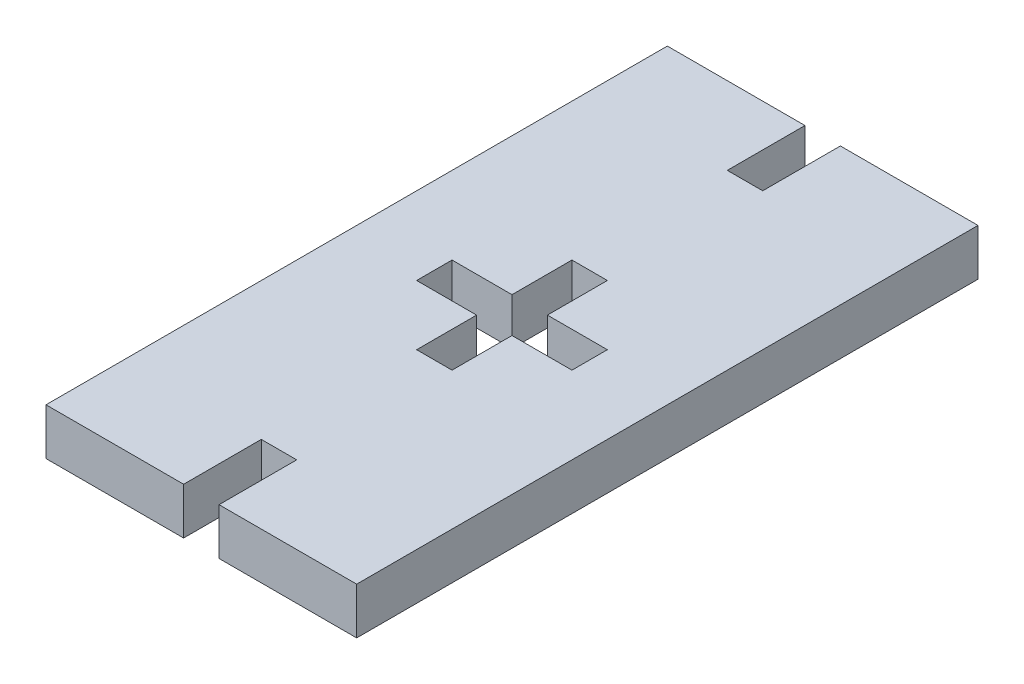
SolidWorks part; units mm, degrees
ref_plane "Alzado" through (0, 0, 0) normal (0, 0, 1) x (1, 0, 0)
ref_plane "Planta" through (0, 0, 0) normal (0, 1, 0) x (1, 0, 0)
ref_plane "Vista lateral" through (0, 0, 0) normal (1, 0, 0) x (0, 0, -1)
sketch "Sketch1" plane through (0, 0, 0) normal (0, 1, 0) x (1, 0, 0)
  line L1 (-10, -20) -> (10, -20)
  line L2 (-10, -20) -> (-10, 20)
  line L3 (-10, 20) -> (10, 20)
  line L4 (10, -20) -> (10, 20)
  line L5 (-10, -20) -> (10, 20) construction
  line L6 (-10, 20) -> (10, -20) construction
  point P0 (0, 0)
extrude "Boss-Extrude1" add sketch "Sketch1" along normal blind 3
sketch "Sketch4" plane through (0, 3, 0) normal (0, 1, 0) x (1, 0, 0)
  line L0 (0, -20) -> (0, 20) construction
  line L1 (-10, -20) -> (10, -20) construction
  line L2 (10, 20) -> (-10, 20) construction
  line L3 (10, 0) -> (-10, 0) construction
  line L4 (-1.14, 25) -> (1.14, 25)
  line L5 (-1.14, 25) -> (-1.14, 15)
  line L6 (-1.14, 15) -> (1.14, 15)
  line L7 (1.14, 25) -> (1.14, 15)
  line L8 (-1.14, 25) -> (1.14, 15) construction
  line L9 (-1.14, 15) -> (1.14, 25) construction
  line L10 (10, -20) -> (10, 20) construction
  line L11 (-10, 20) -> (-10, -20) construction
  line L12 (-1.14, -15) -> (1.14, -15)
  line L13 (1.14, -25) -> (1.14, -15)
  line L14 (-1.14, -25) -> (1.14, -25)
  line L15 (-1.14, -25) -> (-1.14, -15)
extrude "Cut-Extrude8" cut sketch "Sketch4" against normal blind 3 contours L7 L6 L5 L4 | L14 L13 L12 L15
sketch "Sketch5" plane through (0, 3, 0) normal (0, 1, 0) x (1, 0, 0)
  line L1 (-5, -1.14) -> (5, -1.14)
  line L2 (-5, -1.14) -> (-5, 1.14)
  line L3 (-5, 1.14) -> (5, 1.14)
  line L4 (5, -1.14) -> (5, 1.14)
  line L5 (-5, -1.14) -> (5, 1.14) construction
  line L6 (-5, 1.14) -> (5, -1.14) construction
  point P0 (0, 0)
extrude "Cut-Extrude9" cut sketch "Sketch5" against normal blind 10
sketch "Sketch6" plane through (0, 3, 0) normal (0, 1, 0) x (1, 0, 0)
  line L1 (-1.14, 5) -> (1.14, 5)
  line L2 (-1.14, 5) -> (-1.14, -5)
  line L3 (-1.14, -5) -> (1.14, -5)
  line L4 (1.14, 5) -> (1.14, -5)
  line L5 (-1.14, 5) -> (1.14, -5) construction
  line L6 (-1.14, -5) -> (1.14, 5) construction
  point P0 (0, 0)
extrude "Cut-Extrude10" cut sketch "Sketch6" against normal blind 10
equation "\"I\"= 2.28mm"
equation "\"a\"= 10mm"
equation "\"rpl\"= 20mm"
equation "\"rpa\"= 40mm"
equation "\"D1@Sketch1\"=\"rpl\""
equation "\"D2@Sketch1\"=\"rpa\""
equation "\"D1@Sketch4\"=\"I\""
equation "\"D2@Sketch4\"=\"a\""
equation "\"inr\"=10.9608"
equation "\"D2@Sketch5\"=\"a\""
equation "\"D1@Sketch5\"=\"I\""
equation "\"D1@Sketch6\"=\"I\""
equation "\"D2@Sketch6\"=\"a\""
